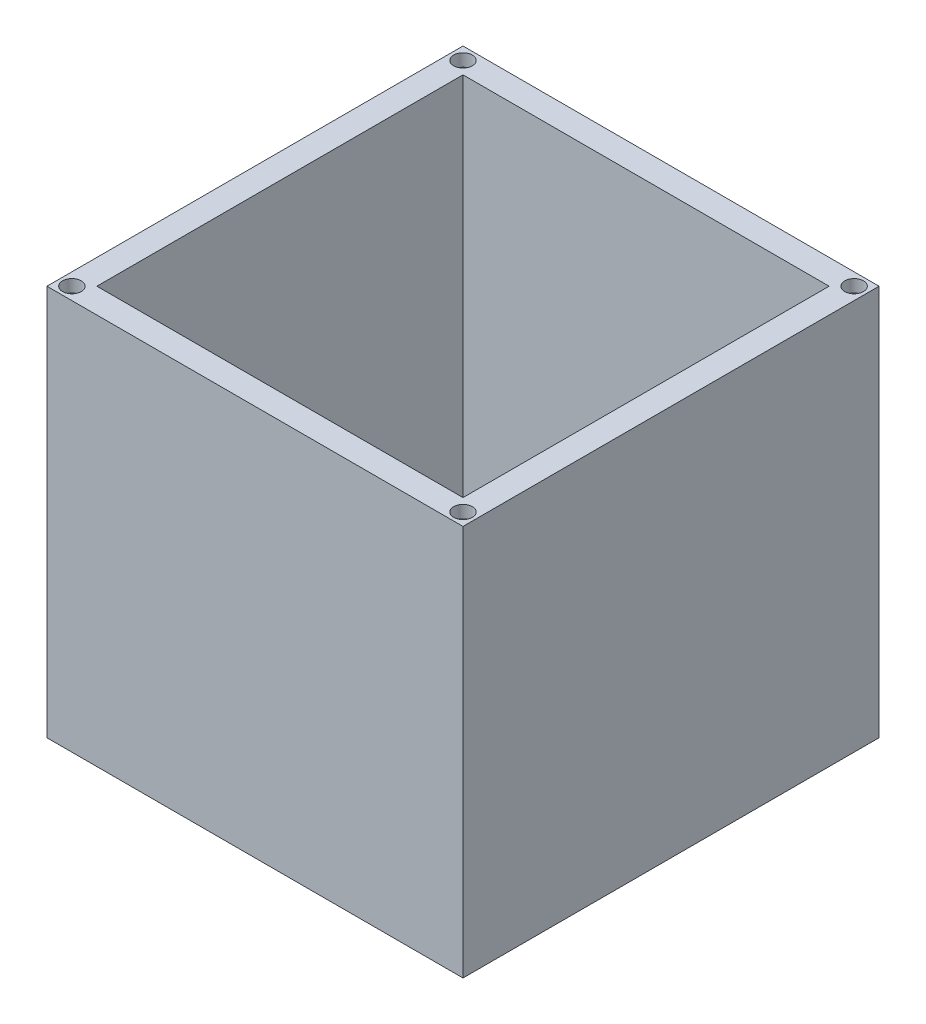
SolidWorks part; units mm, degrees
ref_plane "Front Plane" through (0, 0, 0) normal (0, 0, 1) x (1, 0, 0)
ref_plane "Top Plane" through (0, 0, 0) normal (0, 1, 0) x (1, 0, 0)
ref_plane "Right Plane" through (0, 0, 0) normal (1, 0, 0) x (0, 0, -1)
sketch "Sketch1" plane through (0, 0, 0) normal (0, 1, 0) x (1, 0, 0)
  line L1 (-50, -50) -> (50, -50)
  line L2 (-50, -50) -> (-50, 50)
  line L3 (-50, 50) -> (50, 50)
  line L4 (50, -50) -> (50, 50)
  line L5 (-50, -50) -> (50, 50) construction
  line L6 (-50, 50) -> (50, -50) construction
  point P0 (0, 0)
  dimension "D1" = 100
  dimension "D2" = 100
extrude "Boss-Extrude1" add sketch "Sketch1" against normal blind 94
sketch "Sketch2" plane through (0, 0, 0) normal (0, 1, 0) x (1, 0, 0)
  line L1 (-44, -44) -> (44, -44)
  line L2 (-44, -44) -> (-44, 44)
  line L3 (-44, 44) -> (44, 44)
  line L4 (44, -44) -> (44, 44)
  line L5 (-44, -44) -> (44, 44) construction
  line L6 (-44, 44) -> (44, -44) construction
  point P0 (0, 0)
  dimension "D1" = 88
  dimension "D2" = 88
extrude "Cut-Extrude1" cut sketch "Sketch2" against normal blind 88
sketch "Sketch3" plane through (0, 0, 0) normal (0, 1, 0) x (1, 0, 0)
  line L0 (-44, 44) -> (-50, 44) construction
  line L1 (-44, 44) -> (-44, 50) construction
  line L2 (50, 50) -> (-50, 50) construction
  line L3 (-50, 50) -> (-50, -50) construction
  line L4 (-44, -44) -> (-44, -50) construction
  line L5 (-50, -50) -> (50, -50) construction
  line L6 (-44, -44) -> (-50, -44) construction
  circle A0 centre (-47, 47) radius 2.25
  circle A1 centre (47, 47) radius 2.25
  circle A2 centre (47, -47) radius 2.25
  circle A3 centre (-47, -47) radius 2.25
  point P9 (-47, 47)
  point P20 (0, 0)
  point P23 (-47, -44)
  point P25 (-44, -47)
  dimension "D1" = 4
extrude "Cut-Extrude2" cut sketch "Sketch3" against normal blind 3
